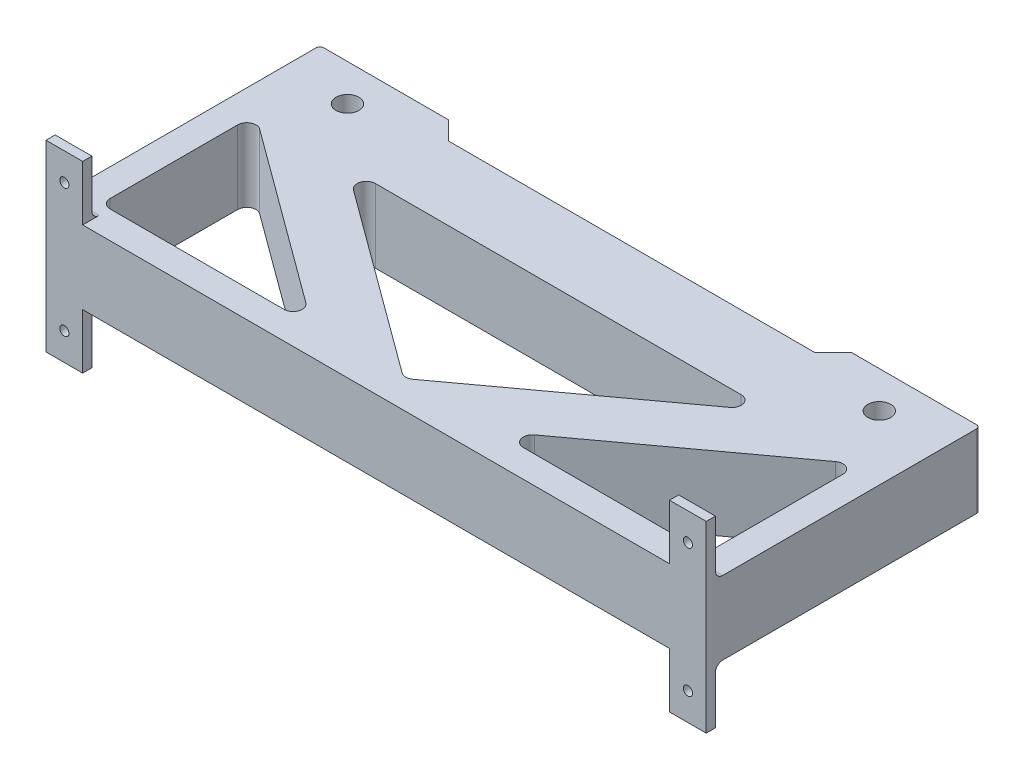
SolidWorks part; units mm, degrees
ref_plane "Front Plane" through (0, 0, 0) normal (0, 0, 1) x (1, 0, 0)
ref_plane "Top Plane" through (0, 0, 0) normal (0, 1, 0) x (1, 0, 0)
ref_plane "Right Plane" through (0, 0, 0) normal (1, 0, 0) x (0, 0, -1)
sketch "Sketch1" plane through (0, 0, 0) normal (0, 1, 0) x (1, 0, 0)
  line L0 (-139.7, 94.8436) -> (-127, 82.1436)
  line L1 (228.6, -94.8436) -> (-228.6, -94.8436)
  line L2 (228.6, -94.8436) -> (228.6, 94.8436)
  line L3 (228.6, 94.8436) -> (139.7, 94.8436)
  line L4 (-228.6, -94.8436) -> (-228.6, 94.8436)
  line L5 (228.6, -94.8436) -> (-228.6, 94.8436) construction
  line L6 (228.6, 94.8436) -> (-228.6, -94.8436) construction
  line L7 (-127, 82.1436) -> (127, 82.1436)
  line L8 (127, 82.1436) -> (139.7, 94.8436)
  line L9 (-139.7, 94.8436) -> (-228.6, 94.8436)
  line L10 (-76.2, -94.8436) -> (-76.2, -105.9725) construction
  line L11 (0, 137.7353) -> (0, 31.3436) construction
  line L21 (146.05, 31.3436) -> (-146.05, 31.3436)
  line L22 (-146.05, 31.3436) -> (0, -75.7936)
  line L24 (-209.55, 31.3436) -> (-209.55, -75.7936)
  line L25 (-209.55, -75.7936) -> (-63.5, -75.7936)
  line L26 (-63.5, -75.7936) -> (-209.55, 31.3436)
  line L27 (0, -75.7936) -> (0, -164.9573) construction
  line L28 (0, 31.3436) -> (0, -75.7936) construction
  line L29 (146.05, 31.3436) -> (0, -75.7936)
  line L30 (209.55, -75.7936) -> (63.5, -75.7936)
  line L31 (209.55, 31.3436) -> (209.55, -75.7936)
  line L32 (63.5, -75.7936) -> (209.55, 31.3436)
  line L33 (-184.15, 94.8436) -> (-184.15, -94.8436) construction
  line L34 (184.15, 94.8436) -> (184.15, -94.8436) construction
  circle A0 centre (-184.15, 69.4436) radius 7.9375
  circle A1 centre (184.15, 69.4436) radius 7.9375
  point P0 (0, 0)
  dimension "D12" = 15.875
  dimension "D13" = 15.875
  dimension "D1" = 457.2
  dimension "D2" = 189.6872
  dimension "D3" = 88.9
  dimension "D4" = 88.9
  dimension "D5" = 254
  dimension "D6" = 19.05
  dimension "D7" = 19.05
  dimension "D8" = 63.5
  dimension "D9" = 63.5
  dimension "D10" = 146.05
  dimension "D11" = 17.9605
  dimension "D14" = 25.4
extrude "Boss-Extrude1" add sketch "Sketch1" along normal blind 50.8
sketch "Sketch2" plane through (0, 0, -94.8436) normal (0, 0, -1) x (-1, 0, 0)
  line L0 (228.6, 25.4) -> (139.7, 25.4) construction
  line L1 (228.6, 50.8) -> (228.6, 0) construction
  line L2 (139.7, 50.8) -> (139.7, 0) construction
  line L3 (-139.7, 25.4) -> (-228.6, 25.4) construction
  line L4 (142.875, 39.4716) -> (225.425, 39.4716)
  line L5 (142.875, 39.4716) -> (142.875, 11.3284)
  line L6 (142.875, 11.3284) -> (225.425, 11.3284)
  line L7 (225.425, 39.4716) -> (225.425, 11.3284)
  line L8 (142.875, 39.4716) -> (225.425, 11.3284) construction
  line L9 (142.875, 11.3284) -> (225.425, 39.4716) construction
  line L10 (-139.7, 50.8) -> (-139.7, 0) construction
  line L11 (-228.6, 50.8) -> (-228.6, 0) construction
  line L13 (-225.425, 39.4716) -> (-142.875, 39.4716)
  line L14 (-225.425, 39.4716) -> (-225.425, 11.3284)
  line L15 (-225.425, 11.3284) -> (-142.875, 11.3284)
  line L16 (-142.875, 39.4716) -> (-142.875, 11.3284)
  line L17 (-225.425, 39.4716) -> (-142.875, 11.3284) construction
  line L18 (-225.425, 11.3284) -> (-142.875, 39.4716) construction
  point P6 (184.15, 25.4)
  point P17 (-184.15, 25.4)
  dimension "D1" = 82.55
  dimension "D2" = 28.1432
  dimension "D3" = 28.1432
  dimension "D4" = 82.55
fillet "Fillet3" radius 6.35 9 edges at (63.5, 25.4, 75.7936) (209.55, 25.4, -31.3436) (209.55, 25.4, 75.7936) (-63.5, 25.4, 75.7936) (-209.55, 25.4, -31.3436) (-209.55, 25.4, 75.7936) (146.05, 25.4, -31.3436) (0, 25.4, 75.7936) (-146.05, 25.4, -31.3436)
extrude "Cut-Extrude1" cut sketch "Sketch2" against normal blind 63.5
sketch "Sketch3" plane through (228.6, 0, 0) normal (1, 0, 0) x (0, 0, -1)
  line L0 (-94.8436, 50.8) -> (94.8436, 50.8) construction
  line L1 (-88.4936, 50.8) -> (-94.8436, 50.8)
  line L2 (-88.4936, 50.8) -> (-88.4936, 88.9)
  line L3 (-88.4936, 88.9) -> (-94.8436, 88.9)
  line L4 (-94.8436, 50.8) -> (-94.8436, 88.9)
  line L6 (-94.8436, 0) -> (-88.4936, 0)
  line L7 (-94.8436, 0) -> (-94.8436, -38.1)
  line L8 (-94.8436, -38.1) -> (-88.4936, -38.1)
  line L9 (-88.4936, 0) -> (-88.4936, -38.1)
  dimension "D1" = 38.1
  dimension "D2" = 38.1
  dimension "D3" = 6.35
  dimension "D4" = 6.35
extrude "Boss-Extrude2" add sketch "Sketch3" against normal blind 25.4
sketch "Sketch4" plane through (-228.6, 0, 0) normal (-1, 0, 0) x (0, 0, 1)
  line L0 (-94.8436, 25.4) -> (94.8436, 25.4) construction
  line L1 (-94.8436, 50.8) -> (-94.8436, 0) construction
  line L2 (94.8436, 50.8) -> (94.8436, 0) construction
  line L4 (94.8436, 50.8) -> (88.4936, 50.8)
  line L5 (94.8436, 50.8) -> (94.8436, 88.9)
  line L6 (94.8436, 88.9) -> (88.4936, 88.9)
  line L7 (88.4936, 50.8) -> (88.4936, 88.9)
  line L8 (94.8436, 0) -> (88.4936, 0)
  line L9 (94.8436, 0) -> (94.8436, -38.1)
  line L10 (94.8436, -38.1) -> (88.4936, -38.1)
  line L11 (88.4936, 0) -> (88.4936, -38.1)
extrude "Boss-Extrude3" add sketch "Sketch4" against normal blind 25.4
fillet "Fillet4" radius 5.08 4 edges at (215.9, 50.8, 88.4936) (-215.9, 50.8, 88.4936) (215.9, 0, 88.4936) (-215.9, 0, 88.4936)
sketch "Sketch5" plane through (0, 0, 0) normal (0, 0, 1) x (1, 0, 0)
  line L0 (0, 0) -> (0, 50.8) construction
  line L1 (127, 50.8) -> (-127, 50.8) construction
  line L2 (228.6, 25.4) -> (-228.6, 25.4) construction
  line L3 (228.6, 50.8) -> (228.6, 0) construction
  line L4 (-228.6, 50.8) -> (-228.6, 0) construction
  line L5 (-203.2, 88.9) -> (-228.6, 88.9) construction
  line L6 (-203.2, 88.9) -> (-203.2, 55.88) construction
  circle A0 centre (-215.9, 69.85) radius 3.175
  circle A1 centre (215.9, 69.85) radius 3.175
  circle A2 centre (-215.9, -19.05) radius 3.175
  circle A3 centre (215.9, -19.05) radius 3.175
  dimension "D1" = 6.35
  dimension "D2" = 19.05
  dimension "D3" = 12.7
extrude "Cut-Extrude2" cut sketch "Sketch5" along normal up to surface (94.8436 mm away)
fillet "Fillet2" radius 2.54 2 edges at (228.6, 25.4, -94.8436) (-228.6, 25.4, -94.8436)
